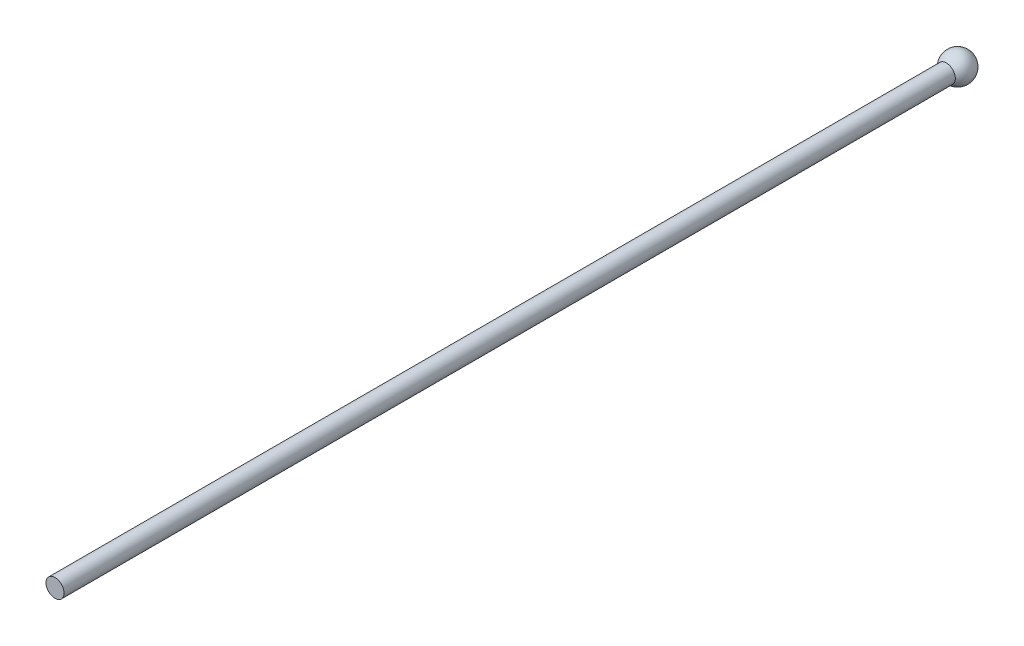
SolidWorks part; units mm, degrees
ref_plane "Plan de face" through (0, 0, 0) normal (0, 0, 1) x (1, 0, 0)
ref_plane "Plan de dessus" through (0, 0, 0) normal (0, 1, 0) x (1, 0, 0)
ref_plane "Plan de droite" through (0, 0, 0) normal (1, 0, 0) x (0, 0, -1)
sketch "Esquisse1" plane through (0, 0, 0) normal (0, 0, 1) x (1, 0, 0)
  circle A0 centre (0, 0) radius 2.5
  dimension "D1" = 5
extrude "Extrusion1" add sketch "Esquisse1" along normal blind 250
sketch "Esquisse2" plane through (0, 0, 0) normal (0, 1, 0) x (1, 0, 0)
  line L0 (0, 15.6408) -> (0, -11.6692) construction
  line L1 (0, 4) -> (0, -4)
  arc A0 (0, -4) -> (0, 4) centre (0, 0) ccw
  dimension "D1" = 8
revolve "Révolution5" add sketch "Esquisse2" angle 360 about L0
